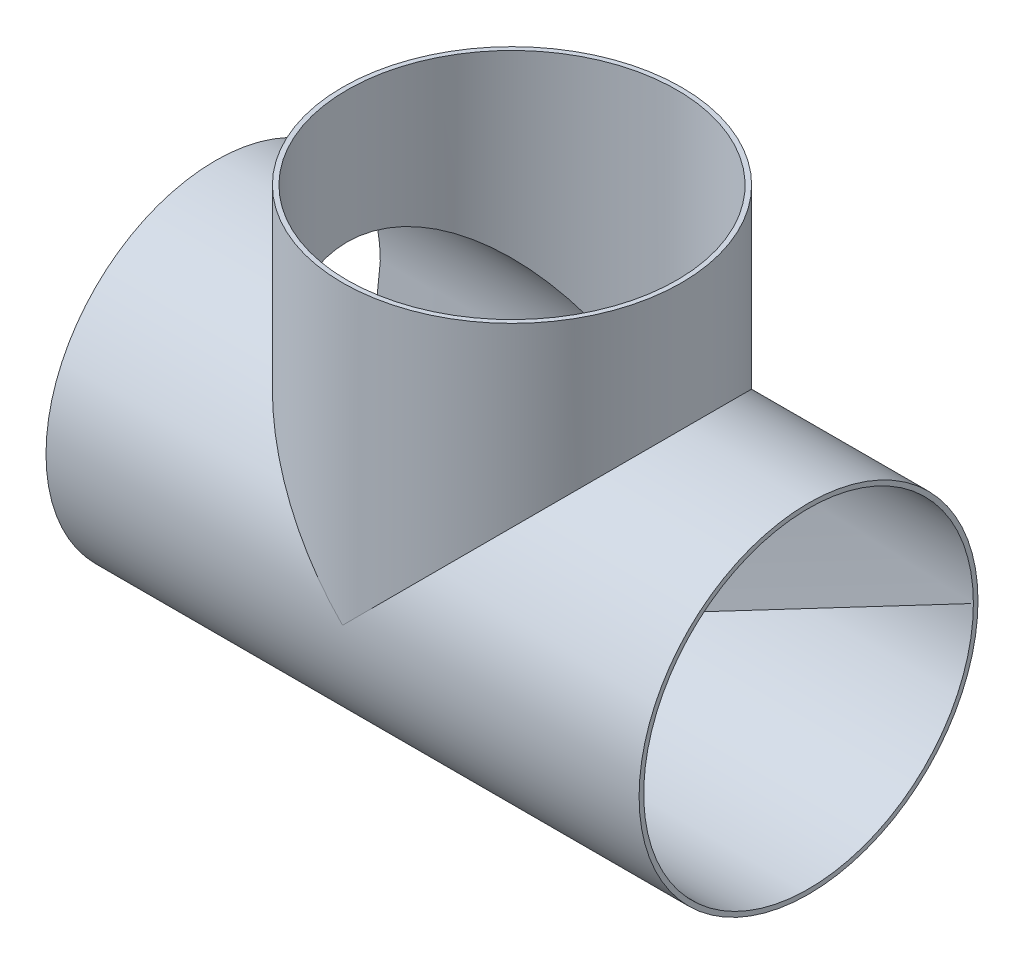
SolidWorks part; units mm, degrees
ref_plane "Front Plane" through (0, 0, 0) normal (0, 0, 1) x (1, 0, 0)
ref_plane "Top Plane" through (0, 0, 0) normal (0, 1, 0) x (1, 0, 0)
ref_plane "Right Plane" through (0, 0, 0) normal (1, 0, 0) x (0, 0, -1)
sketch "Sketch1" plane through (0, 0, 0) normal (1, 0, 0) x (0, 0, -1)
  circle A0 centre (0, 0) radius 101.6
  dimension "D1" = 203.2
extrude "Boss-Extrude1" add sketch "Sketch1" along normal mid plane 355.6
sketch "Sketch2" plane through (0, 0, 0) normal (0, 1, 0) x (1, 0, 0)
  circle A0 centre (0, 0) radius 101.6
  dimension "D1" = 203.2
extrude "Boss-Extrude2" add sketch "Sketch2" along normal blind 177.8
sketch "Sketch3" plane through (0, 0, 0) normal (0, 1, 0) x (1, 0, 0)
  circle A0 centre (0, 0) radius 98.8314
  dimension "D1" = 197.6628
extrude "Cut-Extrude1" cut sketch "Sketch3" along normal blind 177.8
sketch "Sketch4" plane through (0, 0, 0) normal (1, 0, 0) x (0, 0, -1)
  circle A0 centre (0, 0) radius 98.8314
  dimension "D1" = 197.6628
extrude "Cut-Extrude2" cut sketch "Sketch4" against normal mid plane 355.6
